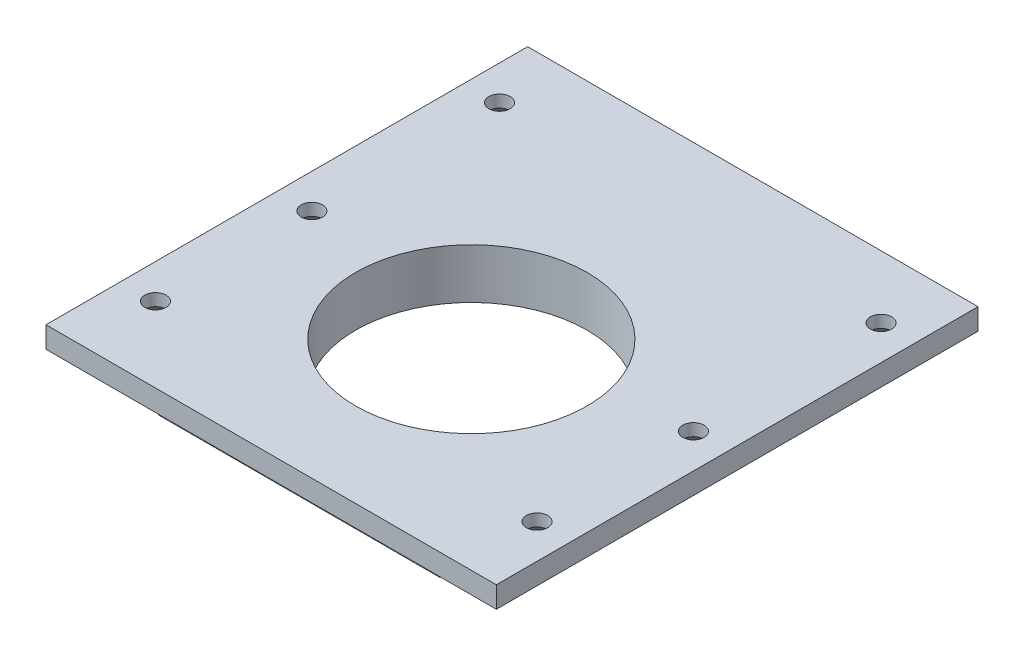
SolidWorks part; units mm, degrees
ref_plane "Front Plane" through (0, 0, 0) normal (0, 0, 1) x (1, 0, 0)
ref_plane "Top Plane" through (0, 0, 0) normal (0, 1, 0) x (1, 0, 0)
ref_plane "Right Plane" through (0, 0, 0) normal (1, 0, 0) x (0, 0, -1)
sketch "Sketch1" plane through (0, 0, 0) normal (1, 0, 0) x (0, 0, -1)
  line L1 (-32, -4) -> (45, -4)
  line L2 (-32, -4) -> (-32, 4)
  line L3 (-32, 4) -> (45, 4)
  line L4 (45, -4) -> (45, 4)
  point P0 (0, 0)
  dimension "D1" = 8
  dimension "D2" = 4
  dimension "D3" = 32
  dimension "D4" = 45
extrude "Boss-Extrude1" add sketch "Sketch1" along normal mid plane 72
sketch "Sketch2" plane through (0, 4, 0) normal (0, 1, 0) x (1, 0, 0)
  circle A0 centre (0, 0) radius 18.5
  dimension "D1" = 37
extrude "Cut-Extrude1" cut sketch "Sketch2" against normal through all
sketch "Sketch3" plane through (0, 0, -45) normal (0, 0, -1) x (-1, 0, 0)
  line L0 (20.4019, 0.5) -> (23, -4)
  line L1 (-36, -4) -> (36, -4) construction
  line L2 (23, -4) -> (36, -4)
  line L3 (36, -4) -> (36, 0.5)
  line L5 (36, 0.5) -> (20.4019, 0.5)
  dimension "D1" = 4.5
  dimension "D2" = 60
  dimension "D3" = 13
extrude "Cut-Extrude2" cut sketch "Sketch3" against normal through all
sketch "Sketch8" plane through (0, 0.5, 0) normal (0, -1, 0) x (1, 0, 0)
  line L0 (-36, -45) -> (-20.4019, -45) construction
  line L1 (-26, -45) -> (-36, -45)
  line L2 (-26, -45) -> (-26, 32)
  line L3 (-26, 32) -> (-36, 32)
  line L4 (-36, -45) -> (-36, 32)
  dimension "D1" = 10
extrude "Cut-Extrude5" cut sketch "Sketch8" against normal blind 0.1
mirror "Mirror3" about plane through (0, 0, 0) normal (1, 0, 0) of "Cut-Extrude5", "Cut-Extrude2"
sketch "Sketch9" plane through (0, -4, 0) normal (0, -1, 0) x (1, 0, 0)
  line L0 (26, -45) -> (26, 32) construction
  line L1 (-26, 32) -> (26, 32)
  line L2 (-26, 32) -> (-26, 27.5)
  line L3 (-26, 27.5) -> (26, 27.5)
  line L4 (26, 32) -> (26, 27.5)
  dimension "D1" = 27.5
extrude "Cut-Extrude6" cut sketch "Sketch9" against normal up to surface (4.6 mm away)
sketch "Sketch10" plane through (0, -4, 0) normal (0, -1, 0) x (1, 0, 0)
  line L0 (26, -45) -> (26, 27.5) construction
  line L1 (-26, -45) -> (26, -45)
  line L2 (-26, -45) -> (-26, -27.5)
  line L3 (-26, -27.5) -> (26, -27.5)
  line L4 (26, -45) -> (26, -27.5)
  dimension "D1" = 27.5
extrude "Cut-Extrude7" cut sketch "Sketch10" against normal up to surface (4.6 mm away)
sketch "Sketch11" [suppressed] plane through (0, -4, 0) normal (0, -1, 0) x (1, 0, 0)
  line L0 (-23, 27.5) -> (-23, -27.5) construction
  line L1 (-23, -12.5) -> (-20, -12.5)
  line L2 (-23, -12.5) -> (-23, 8)
  line L3 (-23, 8) -> (-20, 8)
  line L4 (-20, -12.5) -> (-20, 8)
  line L5 (23, 27.5) -> (23, -27.5) construction
  line L6 (23, -12.5) -> (20, -12.5)
  line L7 (23, -12.5) -> (23, 8)
  line L8 (23, 8) -> (20, 8)
  line L9 (20, -12.5) -> (20, 8)
  line L10 (23, -27.5) -> (-23, -27.5) construction
  dimension "D1" = 20.5
  dimension "D2" = 15
  dimension "D3" = 3
extrude "Cut-Extrude8" [suppressed] cut sketch "Sketch11" against normal up to surface (4.5 mm away)
hole_wizard "Ø1.0 (1) Diameter Hole1" positions "Sketch13" profile "Sketch12" hole size "Ø1.0" standard "ANSI Metric"
sketch "Sketch13" plane through (0, -4, 0) normal (0, -1, 0) x (-1, 0, 0)
  line L0 (15, -22.5) -> (-15, -22.5) construction
  line L1 (-15, -22.5) -> (-15, 22.5) construction
  line L2 (-15, 22.5) -> (15, 22.5) construction
  line L3 (15, 22.5) -> (15, -22.5) construction
  line L4 (15, -22.5) -> (15, -27.5) construction
  line L5 (23, -27.5) -> (-23, -27.5) construction
  line L7 (15, 22.5) -> (15, 27.5) construction
  line L8 (26, 27.5) -> (-26, 27.5) construction
  line L10 (15, 22.5) -> (36, 22.5) construction
  line L11 (36, -32) -> (36, 45) construction
  line L13 (-15, 22.5) -> (-36, 22.5) construction
  line L14 (-36, -32) -> (-36, 45) construction
  point P0 (15, -22.5)
  point P2 (-15, -22.5)
  point P4 (-15, 22.5)
  point P6 (15, 22.5)
  dimension "D1" = 30
  dimension "D2" = 45
sketch "Sketch12" plane through (-15, -4, 22.5) normal (1, 0, 0) x (0, 0, -1)
  line L0 (0, 0) -> (0, 2.3004)
  line L1 (0, 2.3004) -> (0.5, 2)
  line L2 (0.5, 2) -> (0.5, 0)
  line L5 (0.5, 0) -> (0, 0)
  line L10 (0, 2.3004) -> (-0.5, 2) construction
  line L11 (0, -6.35) -> (0, 107.95) construction
  dimension "Hole Dia." = 1
  dimension "Hole Depth" = 2
  dimension "Drill Angle" = 118
sketch "Sketch14" [suppressed] plane through (0, -4, 0) normal (0, -1, 0) x (1, 0, 0)
  line L0 (23, -24.5) -> (23, -27.5)
  line L1 (23, -12.5) -> (23, -27.5) construction
  line L2 (-26, -27.5) -> (26, -27.5) construction
  line L3 (23, -27.5) -> (21.2679, -27.5)
  line L4 (23, -27.5) -> (-23, -27.5) construction
  line L5 (21.2679, -27.5) -> (23, -24.5)
  line L6 (-23, -27.5) -> (-23, -24.5)
  line L7 (-23, -12.5) -> (-23, -27.5) construction
  line L8 (-23, -24.5) -> (-21.2679, -27.5)
  line L9 (-21.2679, -27.5) -> (-23, -27.5)
  line L10 (-23, -24.5) -> (23, -24.5) construction
  line L11 (23, 11) -> (23, 8)
  line L12 (23, 27.5) -> (23, 8) construction
  line L13 (23, 8) -> (21.2679, 8)
  line L14 (23, 8) -> (20, 8) construction
  line L15 (21.2679, 8) -> (23, 11)
  line L16 (-23, 11) -> (-23, 8)
  line L17 (-23, 27.5) -> (-23, 8) construction
  line L18 (-23, 8) -> (-21.2679, 8)
  line L20 (-21.2679, 8) -> (-23, 11)
  line L21 (-23, 11) -> (23, 11) construction
  dimension "D1" = 30
  dimension "D2" = 3
  dimension "D3" = 30
  dimension "D4" = 30
  dimension "D5" = 30
  dimension "D6" = 3
extrude "Cut-Extrude9" [suppressed] cut sketch "Sketch14" against normal up to surface (4.5 mm away)
hole_wizard "CSK for M3 Flat Head Machine Screw1" positions "Sketch18" profile "Sketch17" countersink size "M3" standard "ANSI Metric"
sketch "Sketch18" plane through (0, 0.6, 0) normal (0, -1, 0) x (-1, 0, 0)
  line L0 (30.5, -20) -> (30.5, 5) construction
  line L1 (30.5, 5) -> (30.5, 35) construction
  line L2 (30.5, 35) -> (-30.5, 35) construction
  line L3 (-30.5, 35) -> (-30.5, 5) construction
  line L4 (-30.5, 5) -> (-30.5, -20) construction
  line L5 (-30.5, -20) -> (30.5, -20) construction
  line L7 (30.5, -20) -> (30.5, 5) construction
  line L8 (30.5, 5) -> (30.5, 35) construction
  line L10 (36, 45) -> (-36, 45) construction
  line L11 (-36, -32) -> (-36, 45) construction
  line L12 (36, -32) -> (36, 45) construction
  point P0 (30.5, -20)
  point P2 (30.5, 5)
  point P4 (30.5, 35)
  point P6 (-30.5, 35)
  point P8 (-30.5, 5)
  point P10 (-30.5, -20)
  dimension "D1" = 10
  dimension "D2" = 30
  dimension "D3" = 25
  dimension "D4" = 5.5
  dimension "D5" = 5.5
  dimension "D6" = 25
sketch "Sketch17" plane through (-30.5, 0.6, 20) normal (1, 0, 0) x (0, 0, -1)
  line L0 (0, 0) -> (0, 3.4)
  line L1 (0, 3.4) -> (1.7, 3.4)
  line L2 (1.7, 3.4) -> (1.7, 1.45)
  line L3 (1.7, 1.45) -> (3.15, 0)
  line L5 (3.15, 0) -> (0, 0)
  line L6 (-1.7, 1.45) -> (-3.15, 0) construction
  line L11 (0, -6.35) -> (0, 107.95) construction
  dimension "Thru Hole Dia." = 3.4
  dimension "Thru Hole Depth" = 3.4
  dimension "Near C'Sink Dia." = 6.3
  dimension "Near C'Sink Angle" = 90
sketch "Sketch19" plane through (0, 0, -45) normal (0, 0, -1) x (-1, 0, 0)
  line L0 (0, -4) -> (0, 4) construction
  line L1 (-36, 4) -> (36, 4) construction
  circle A0 centre (0, 2.25) radius 1.5
  dimension "D1" = 3
  dimension "D2" = 1.75
extrude "Cut-Extrude10" [suppressed] cut sketch "Sketch19" against normal blind 20
hole_wizard "M3x0.5 Tapped Hole1" positions "Sketch21" profile "Sketch20" tap size "M3x0.5" standard "ANSI Metric"
sketch "Sketch21" [suppressed] plane through (0, 0, -25) normal (0, 0, -1) x (-1, 0, 0)
  point P0 (0, 2.25)
sketch "Sketch20" plane through (0, 2.25, -25) normal (1, 0, 0) x (0, 1, 0)
  line L0 (0, 0) -> (0, 6.5)
  line L1 (0, 6.5) -> (1.25, 6.5)
  line L2 (1.25, 6.5) -> (1.25, 0)
  line L5 (1.25, 0) -> (0, 0)
  line L11 (0, -6.35) -> (0, 107.95) construction
  dimension "Thru Tap Drill Dia." = 2.5
  dimension "Thru Tap Drill Depth" = 6.5
sketch "Sketch22" plane through (0, 0, 27.5) normal (0, 0, 1) x (1, 0, 0)
  line L0 (22.5, -4) -> (22.5, -3.134)
  line L3 (-23, -4) -> (23, -4) construction
  line L4 (23, -4) -> (20.4019, 0.5) construction
  line L5 (22.5, -3.134) -> (23, -4)
  line L6 (23, -4) -> (22.5, -4)
  line L7 (-22.5, -4) -> (-22.5, -3.134)
  line L8 (-23, -4) -> (-20.4019, 0.5) construction
  line L9 (-22.5, -3.134) -> (-23, -4)
  line L10 (-23, -4) -> (-22.5, -4)
  dimension "D1" = 0.5
  dimension "D2" = 0.5
extrude "Cut-Extrude11" cut sketch "Sketch22" against normal through all
sketch "Sketch29" plane through (0, -4, 0) normal (0, -1, 0) x (1, 0, 0)
  line L0 (-22.5, -27.5) -> (-22.5, -24.5)
  line L1 (-22.5, -27.5) -> (-22.5, 27.5) construction
  line L2 (-22.5, -24.5) -> (-20.7679, -27.5)
  line L3 (22.5, -27.5) -> (-22.5, -27.5) construction
  line L4 (-20.7679, -27.5) -> (-22.5, -27.5)
  line L5 (22.5, -27.5) -> (22.5, -24.5)
  line L6 (22.5, -27.5) -> (22.5, 27.5) construction
  line L7 (22.5, -24.5) -> (20.7679, -27.5)
  line L8 (-26, -27.5) -> (26, -27.5) construction
  line L9 (20.7679, -27.5) -> (22.5, -27.5)
  line L10 (-22.5, -24.5) -> (22.5, -24.5) construction
  dimension "D1" = 3
  dimension "D2" = 30
  dimension "D3" = 30
extrude "Cut-Extrude15" cut sketch "Sketch29" against normal up to surface (4.5 mm away)
